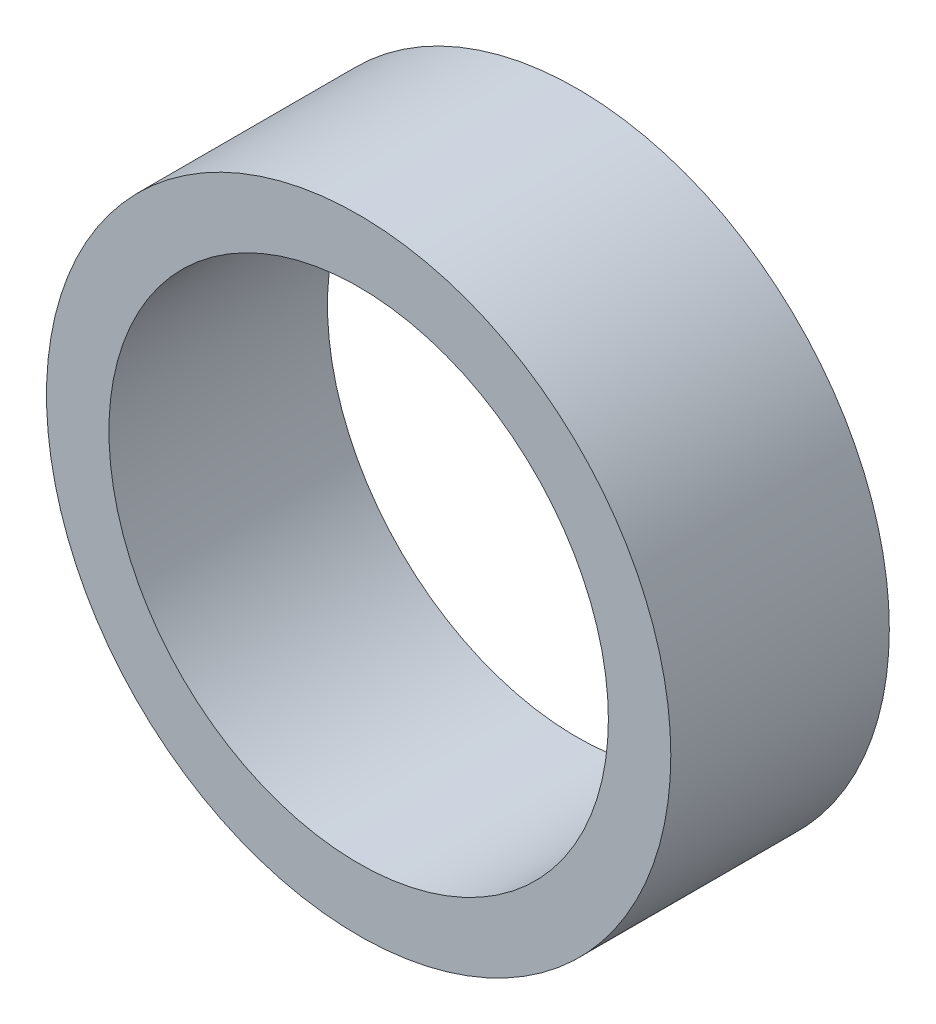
SolidWorks part; units mm, degrees
ref_plane "Спереди" through (0, 0, 0) normal (0, 0, 1) x (1, 0, 0)
ref_plane "Сверху" through (0, 0, 0) normal (0, 1, 0) x (1, 0, 0)
ref_plane "Справа" through (0, 0, 0) normal (1, 0, 0) x (0, 0, -1)
sketch "Эскиз1" plane through (0, 0, 0) normal (0, 0, 1) x (1, 0, 0)
  circle A0 centre (0, 0) radius 4
  circle A1 centre (0, 0) radius 5
  dimension "D1" = 8
  dimension "D2" = 10
extrude "Бобышка-Вытянуть1" add sketch "Эскиз1" along normal blind 3.5
